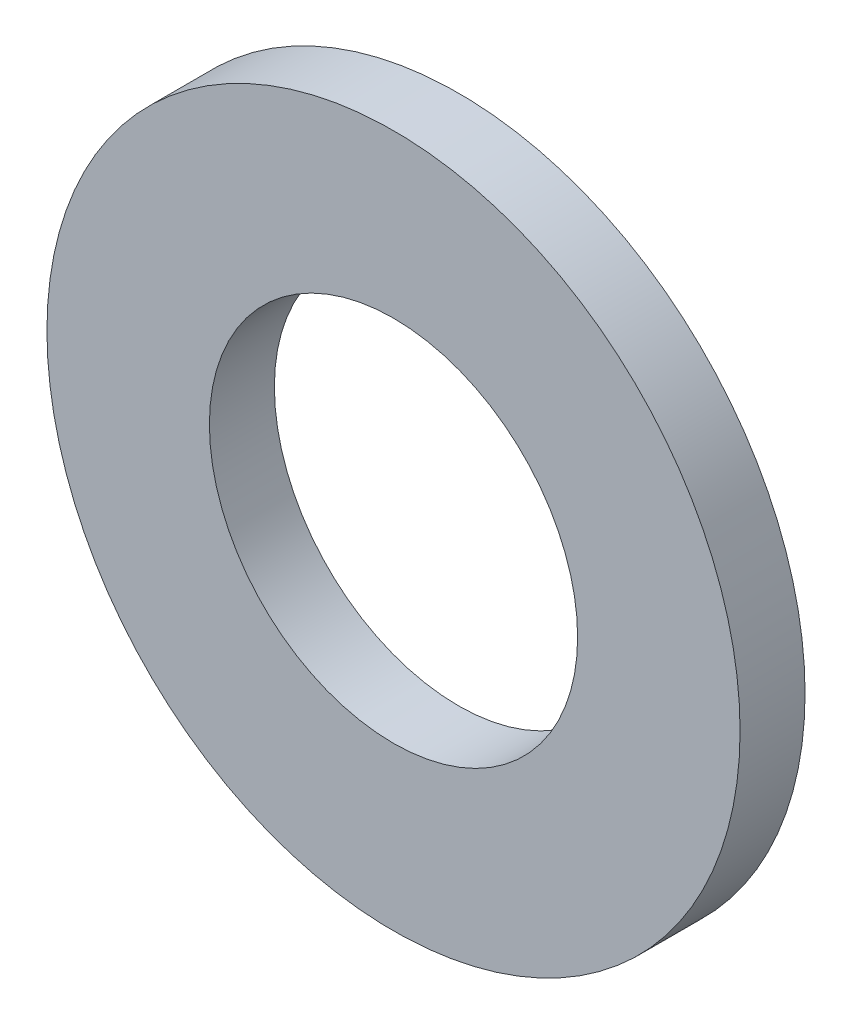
SolidWorks part; units mm, degrees
ref_plane "Face" through (0, 0, 0) normal (0, 0, 1) x (1, 0, 0)
ref_plane "Dessus" through (0, 0, 0) normal (0, 1, 0) x (1, 0, 0)
ref_plane "Droite" through (0, 0, 0) normal (1, 0, 0) x (0, 0, -1)
sketch "Esquisse1" plane through (0, 0, 0) normal (0, 0, 1) x (1, 0, 0)
  circle A0 centre (0, 0) radius 4.25
  circle A1 centre (0, 0) radius 8
  dimension "D1" = 16
  dimension "D2" = 8.5
extrude "Base-Extrusion" add sketch "Esquisse1" against normal blind 1.5
